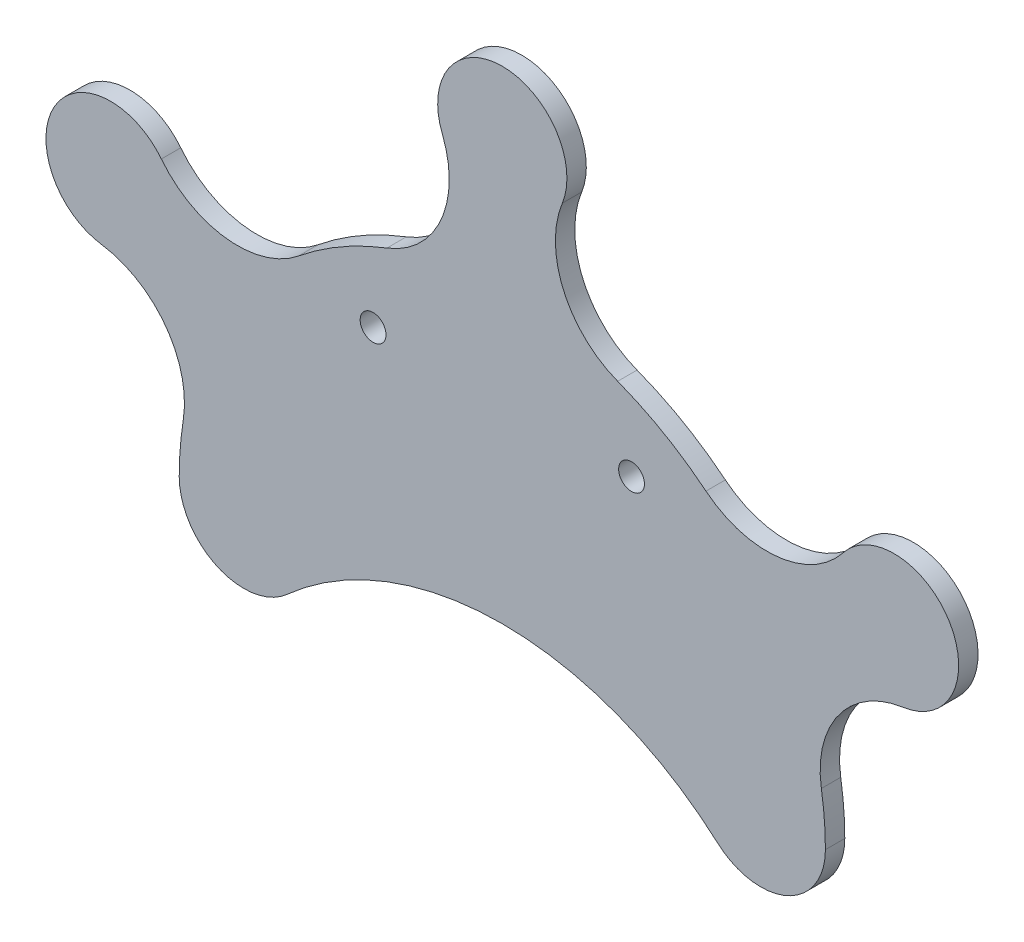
SolidWorks part; units mm, degrees
ref_plane "Front Plane" through (0, 0, 0) normal (0, 0, 1) x (1, 0, 0)
ref_plane "Top Plane" through (0, 0, 0) normal (0, 1, 0) x (1, 0, 0)
ref_plane "Right Plane" through (0, 0, 0) normal (1, 0, 0) x (0, 0, -1)
sketch "Sketch2" plane through (0, 0, 0) normal (0, 0, 1) x (1, 0, 0)
  line L0 (0, 0) -> (-50, 0) construction
  line L1 (0, -44.7214) -> (0, 80) construction
  line L2 (0, 0) -> (-60.6218, 35) construction
  line L3 (0, 0) -> (-64.1859, 10.2554) construction
  line L4 (0, 0) -> (-40.9743, 50.4589) construction
  line L5 (0, 0) -> (-23.2115, 60.7143) construction
  arc A0 (-17.855, 46.7033) -> (-31.5187, 38.8146) centre (0, 0) ccw
  arc A1 (-50, 0) -> (-33.3333, -7.4536) centre (-40, 0) ccw
  arc A2 (33.3333, -7.4536) -> (-33.3333, -7.4536) centre (0, -44.7214) ccw
  arc A3 (-52.7628, 41.1836) -> (-62.0474, 25.1021) centre (-60.6218, 35) ccw
  arc A4 (-49.3738, 7.8887) -> (-62.0474, 25.1021) centre (-64.1859, 10.2554) ccw
  arc A5 (9.2846, 66.2857) -> (-9.2846, 66.2857) centre (0, 70) ccw
  arc A6 (0, 70) -> (-60.6218, 35) centre (0, 0) ccw construction
  arc A7 (17.855, 46.7033) -> (9.2846, 66.2857) centre (23.2115, 60.7143) cw
  arc A8 (-17.855, 46.7033) -> (-9.2846, 66.2857) centre (-23.2115, 60.7143) ccw
  arc A9 (-52.7628, 41.1836) -> (-31.5187, 38.8146) centre (-40.9743, 50.4589) ccw
  arc A10 (-49.3738, 7.8887) -> (-50, 0) centre (0, 0) ccw
  arc A11 (17.855, 46.7033) -> (31.5187, 38.8146) centre (0, 0) cw
  arc A12 (52.7628, 41.1836) -> (31.5187, 38.8146) centre (40.9743, 50.4589) cw
  arc A13 (52.7628, 41.1836) -> (62.0474, 25.1021) centre (60.6218, 35) cw
  arc A14 (49.3738, 7.8887) -> (62.0474, 25.1021) centre (64.1859, 10.2554) cw
  arc A15 (49.3738, 7.8887) -> (50, 0) centre (0, 0) cw
  arc A16 (50, 0) -> (33.3333, -7.4536) centre (40, 0) cw
  circle A17 centre (20, 35) radius 2
  arc A18 (0, 65) -> (-64.1859, 10.2554) centre (0, 0) ccw construction
  circle A19 centre (-20, 35) radius 2
  dimension "D1" = 10
  dimension "D5" = 30
  dimension "D6" = 70
  dimension "D7" = 30
  dimension "D8" = 4
  dimension "D4" = 44.7214
  dimension "D2" = 50
  dimension "D3" = 50
  dimension "D9" = 4
  dimension "D10" = 20
  dimension "D11" = 35
  dimension "D12" = 35
  dimension "D13" = 20
extrude "Extrude1" add sketch "Sketch2" along normal blind 3
